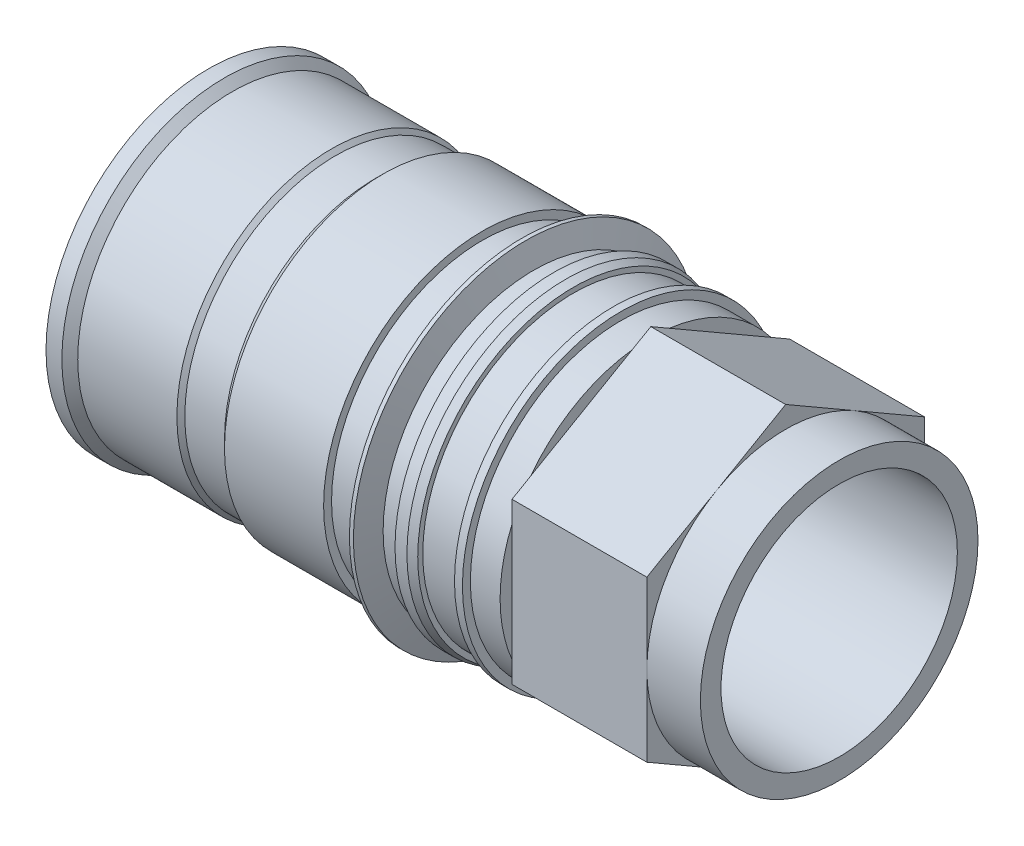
SolidWorks part; units mm, degrees
ref_plane "Alzado" through (0, 0, 0) normal (0, 0, 1) x (1, 0, 0)
ref_plane "Planta" through (0, 0, 0) normal (0, 1, 0) x (1, 0, 0)
ref_plane "Vista lateral" through (0, 0, 0) normal (1, 0, 0) x (0, 0, -1)
sketch "Croquis1" plane through (0, 0, 0) normal (0, 0, 1) x (1, 0, 0)
  line L0 (0, 0) -> (150.0259, 0) construction
  line L1 (0, 0) -> (0, 41)
  line L2 (0, 41) -> (4, 41)
  line L3 (4, 41) -> (6, 39)
  line L4 (6, 39) -> (31, 39)
  line L5 (31, 39) -> (32, 38)
  line L6 (32, 38) -> (42, 38)
  line L7 (42, 38) -> (44, 40)
  line L8 (44, 40) -> (69, 40)
  line L9 (69, 40) -> (69, 38)
  line L10 (69, 38) -> (77, 38)
  line L11 (77, 38) -> (79, 43.495)
  line L12 (79, 43.495) -> (80, 43.495)
  line L13 (80, 43.495) -> (82, 38)
  line L14 (82, 38) -> (87, 38)
  line L15 (87, 38) -> (87, 40)
  line L16 (87, 40) -> (90, 40)
  line L17 (90, 40) -> (92, 39.2721)
  line L18 (92, 39.2721) -> (92, 38)
  line L19 (92, 38) -> (102, 38)
  line L20 (102, 38) -> (102, 40)
  line L21 (102, 40) -> (104, 40)
  line L22 (104, 40) -> (104, 38)
  line L23 (104, 38) -> (111.5, 38)
  line L24 (111.5, 38) -> (111.5, 0)
  line L25 (111.5, 0) -> (0, 0)
  dimension "D1" = 111.5
  dimension "D2" = 82
  dimension "D3" = 4
  dimension "D4" = 135
  dimension "D5" = 2
  dimension "D6" = 25
  dimension "D7" = 1
  dimension "D8" = 10
  dimension "D9" = 2
  dimension "D10" = 25
  dimension "D11" = 2
  dimension "D12" = 8
  dimension "D13" = 2
  dimension "D14" = 110
  dimension "D15" = 1
  dimension "D16" = 2
  dimension "D17" = 5
  dimension "D18" = 2
  dimension "D19" = 3
  dimension "D20" = 10
  dimension "D21" = 2
  dimension "D22" = 2
revolve "Revolución1" add sketch "Croquis1" angle 360 about L0
sketch "Croquis2" plane through (111.5, 0, 0) normal (1, 0, 0) x (0, 0, -1)
  line L1 (0, 40.4145) -> (-35, 20.2073)
  line L2 (-35, 20.2073) -> (-35, -20.2073)
  line L3 (-35, -20.2073) -> (0, -40.4145)
  line L4 (0, -40.4145) -> (35, -20.2073)
  line L5 (35, -20.2073) -> (35, 20.2073)
  line L6 (35, 20.2073) -> (0, 40.4145)
  circle A0 centre (0, 0) radius 35 construction
  dimension "D1" = 70
extrude "Saliente-Extruir1" add sketch "Croquis2" along normal blind 34
sketch "Croquis3" plane through (145.5, 0, 0) normal (1, 0, 0) x (0, 0, -1)
  circle A0 centre (0, 0) radius 35
  dimension "D1" = 70
extrude "Saliente-Extruir2" add sketch "Croquis3" along normal blind 13.5
sketch "Croquis4" plane through (159, 0, 0) normal (1, 0, 0) x (0, 0, -1)
  circle A0 centre (0, 0) radius 29.8
  dimension "D1" = 59.6
extrude "Cortar-Extruir1" cut sketch "Croquis4" against normal through all
